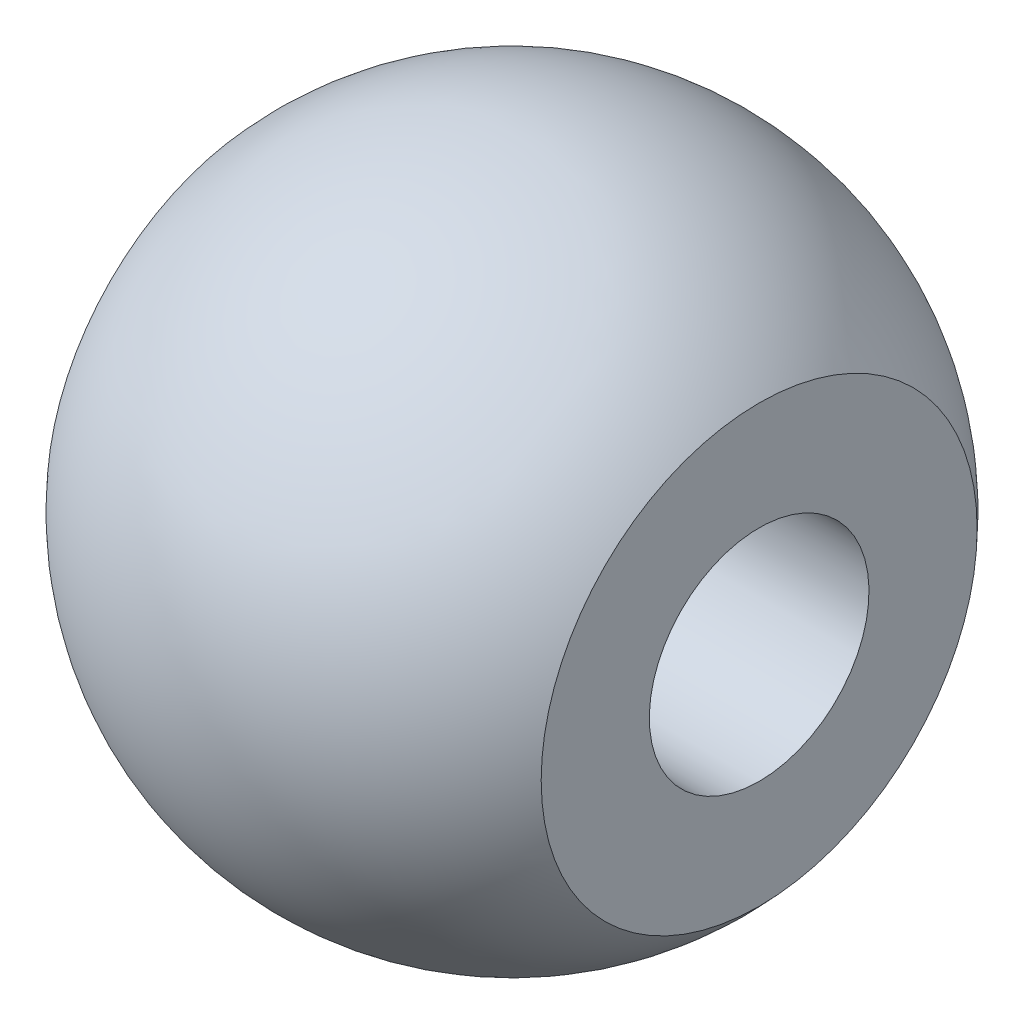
SolidWorks part; units mm, degrees
ref_plane "Front Plane" through (0, 0, 0) normal (0, 0, 1) x (1, 0, 0)
ref_plane "Top Plane" through (0, 0, 0) normal (0, 1, 0) x (1, 0, 0)
ref_plane "Right Plane" through (0, 0, 0) normal (1, 0, 0) x (0, 0, -1)
sketch "Sketch1" plane through (0, 0, 0) normal (0, 0, 1) x (1, 0, 0)
  line L0 (-4.5, 0) -> (4.5, 0) construction
  line L1 (-4.5, 3.9686) -> (-3.5, 2)
  line L3 (-3.5, 2) -> (4.5, 2)
  line L4 (4.5, 2) -> (4.5, 3.9686)
  arc A1 (4.5, 3.9686) -> (-4.5, 3.9686) centre (0, 0) ccw
  point P1 (0, 0)
  dimension "D2" = 9
  dimension "D1" = 6
  dimension "D3" = 1
  dimension "D4" = 4
  dimension "D5" = 4.5
revolve "Revolve1" add sketch "Sketch1" angle 360 about L0
